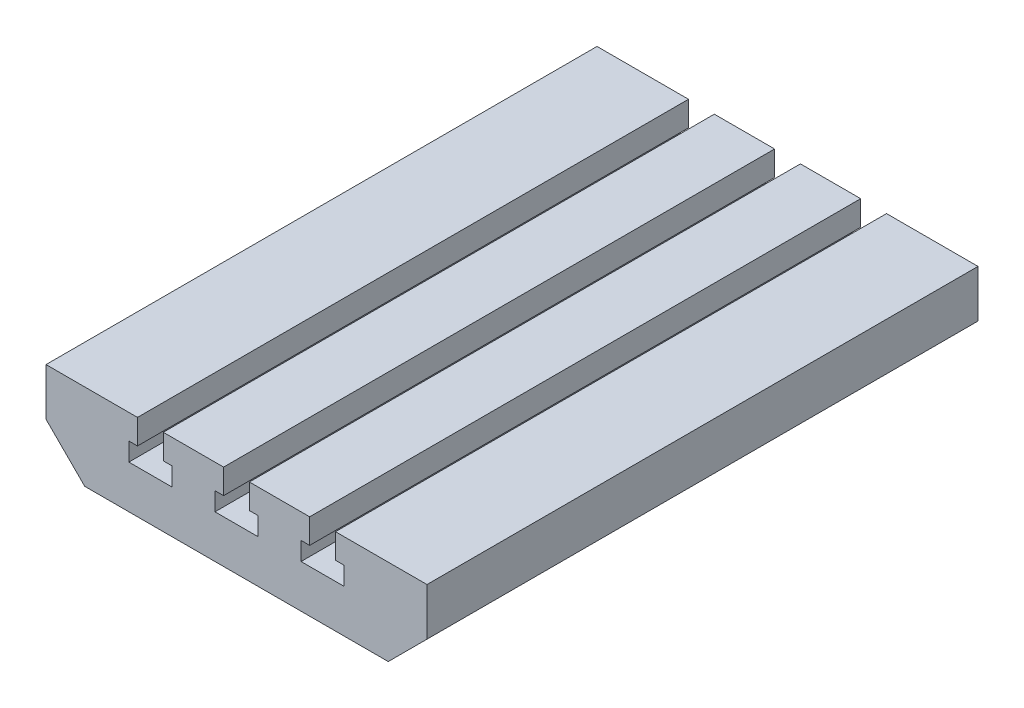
SolidWorks part; units mm, degrees
ref_plane "Front Plane" through (0, 0, 0) normal (0, 0, 1) x (1, 0, 0)
ref_plane "Top Plane" through (0, 0, 0) normal (0, 1, 0) x (1, 0, 0)
ref_plane "Right Plane" through (0, 0, 0) normal (1, 0, 0) x (0, 0, -1)
sketch "Sketch1" plane through (0, 0, 0) normal (0, 0, 1) x (1, 0, 0)
  line L0 (-88.5, 40) -> (-46, 40)
  line L1 (88.5, 40) -> (88.5, 18)
  line L2 (88.5, 18) -> (70.5, 0)
  line L3 (70.5, 0) -> (-70.5, 0)
  line L4 (-70.5, 0) -> (-88.5, 18)
  line L5 (-88.5, 40) -> (-88.5, 18)
  line L6 (-46, 40) -> (-46, 28.5)
  line L7 (-46, 28.5) -> (-50, 28.5)
  line L8 (-50, 28.5) -> (-50, 20)
  line L9 (-50, 20) -> (-30, 20)
  line L10 (-30, 20) -> (-30, 28.5)
  line L11 (-30, 28.5) -> (-34, 28.5)
  line L12 (-34, 28.5) -> (-34, 40)
  line L13 (-6, 40) -> (-6, 28.5)
  line L14 (-6, 28.5) -> (-10, 28.5)
  line L15 (-10, 28.5) -> (-10, 20)
  line L16 (-10, 20) -> (10, 20)
  line L17 (10, 20) -> (10, 28.5)
  line L18 (10, 28.5) -> (6, 28.5)
  line L19 (6, 28.5) -> (6, 40)
  line L20 (34, 40) -> (34, 28.5)
  line L21 (34, 28.5) -> (30, 28.5)
  line L22 (30, 28.5) -> (30, 20)
  line L23 (30, 20) -> (50, 20)
  line L24 (50, 20) -> (50, 28.5)
  line L25 (50, 28.5) -> (46, 28.5)
  line L26 (46, 28.5) -> (46, 40)
  line L27 (-34, 40) -> (-6, 40)
  line L28 (6, 40) -> (34, 40)
  line L29 (46, 40) -> (88.5, 40)
  point P2 (88.603, 15)
  point P8 (0, 0)
  point P25 (0, 20)
  point P34 (-40, 20)
  point P35 (40, 20)
  point P36 (78.5, 0)
  point P37 (0, 0)
  dimension "D1" = 177
  dimension "D2" = 22
  dimension "D3" = 12
  dimension "D4" = 20
  dimension "D5" = 8.5
  dimension "D6" = 20
  dimension "D7" = 4
  dimension "D8" = 12
  dimension "D9" = 20
  dimension "D10" = 8.5
  dimension "D11" = 20
  dimension "D12" = 4
  dimension "D13" = 40
  dimension "D14" = 20
  dimension "D15" = 12
  dimension "D16" = 8.5
  dimension "D17" = 20
  dimension "D18" = 4
extrude "Boss-Extrude1" add sketch "Sketch1" along normal blind 256
